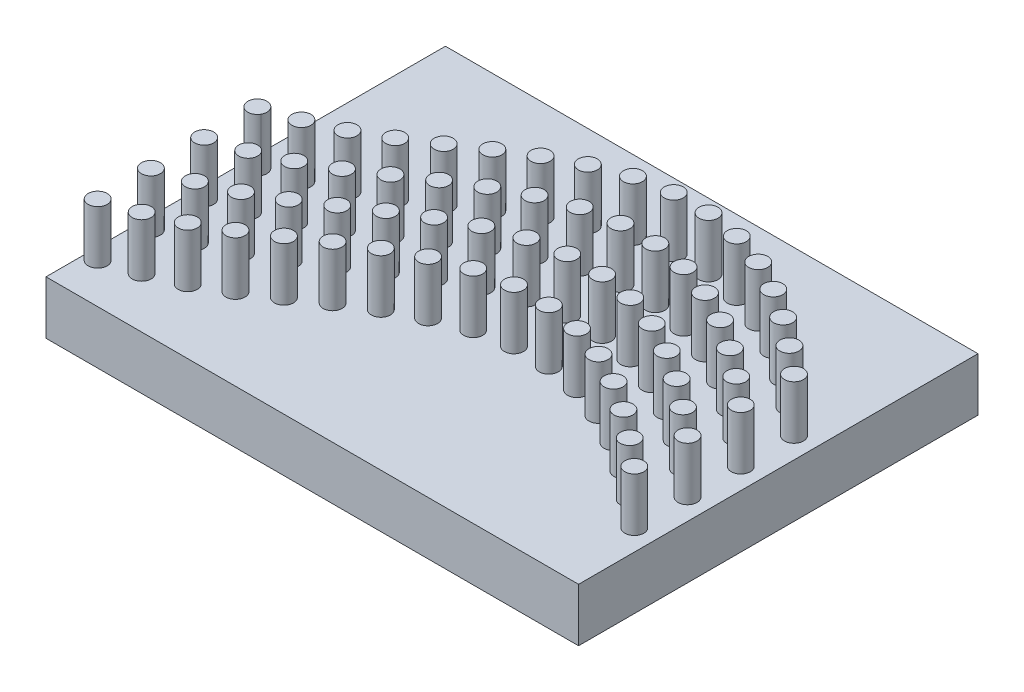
SolidWorks part; units mm, degrees
ref_plane "Front" through (0, 0, 0) normal (0, 0, 1) x (1, 0, 0)
ref_plane "Top" through (0, 0, 0) normal (0, 1, 0) x (1, 0, 0)
ref_plane "Right" through (0, 0, 0) normal (1, 0, 0) x (0, 0, -1)
sketch "Sketch1" plane through (0, 0, 0) normal (0, 1, 0) x (1, 0, 0)
  line L0 (100, -75) -> (-100, 75) construction
  line L1 (-100, 75) -> (100, 75)
  line L2 (-100, 75) -> (-100, -75)
  line L3 (-100, -75) -> (100, -75)
  line L4 (100, 75) -> (100, -75)
  dimension "D1" = 200
  dimension "D2" = 150
extrude "Extrude1" add sketch "Sketch1" along normal blind 20
sketch "Sketch2" plane through (0, 20, 0) normal (0, 1, 0) x (-1, 0, 0)
  point P0 (95.6421, -0.0072)
  point P1 (58.3316, -16.5309)
  point P2 (3.7785, -47.5667)
  point P3 (-48.042, -43.9375)
  point P4 (-92.0723, -13.8248)
sketch "Sketch3" plane through (0, 20, 0) normal (0, 1, 0) x (-1, 0, 0)
  circle A0 centre (95.6421, -0.0072) radius 3.5701
extrude "Extrude2" add sketch "Sketch3" along normal blind 20
pattern_curve "CrvPattern1" parameters "D1"=17, "D3"=50, "D2"=4, "D4"=20
